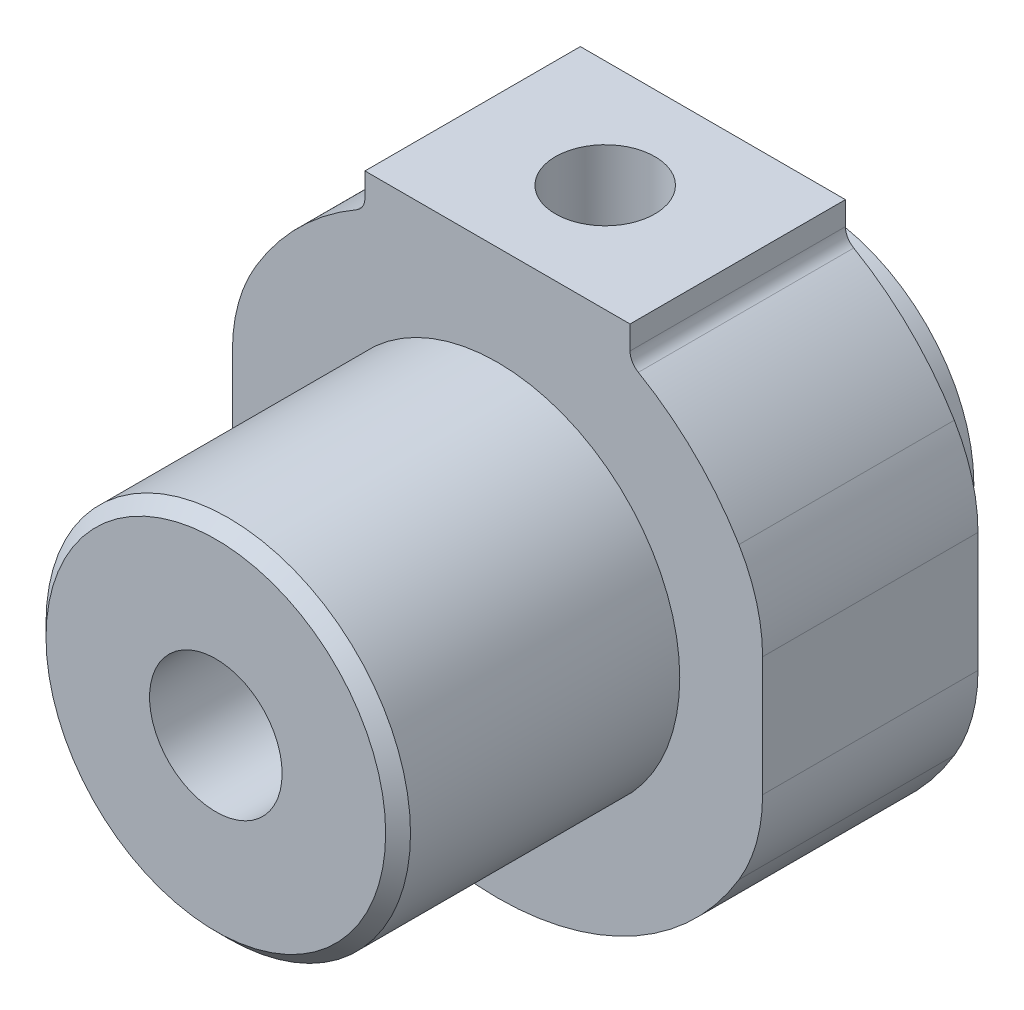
SolidWorks part; units mm, degrees
ref_plane "face" through (0, 0, 0) normal (0, 0, 1) x (1, 0, 0)
ref_plane "dessus" through (0, 0, 0) normal (0, 1, 0) x (1, 0, 0)
ref_plane "gauche" through (0, 0, 0) normal (1, 0, 0) x (0, 0, -1)
sketch "Esquisse1" plane through (0, 0, 0) normal (0, 0, 1) x (1, 0, 0)
  line L0 (0, 20) -> (0, -10) construction
  line L1 (-8, 17) -> (8, 17)
  line L2 (8, 17) -> (8, 15.5885)
  line L3 (0, 17) -> (0, -20) construction
  line L4 (-8, 17) -> (-8, 15.5885)
  arc A0 (-8.5, 14.7224) -> (8.5, 14.7224) centre (0, 0) ccw
  arc A1 (8.5, 14.7224) -> (8, 15.5885) centre (9, 15.5885) cw
  arc A2 (-8.5, 14.7224) -> (-8, 15.5885) centre (-9, 15.5885) ccw
  point P8 (0, 12.5)
  point P11 (8, 15)
  dimension "D1" = 34
  dimension "D4" = 1
  dimension "D2" = 17
  dimension "D3" = 8
extrude "Base-Extrusion" add sketch "Esquisse1" along normal blind 13
sketch "Esquisse2" plane through (0, 0, 13) normal (0, 0, 1) x (1, 0, 0)
  circle A0 centre (0, 0) radius 11
  dimension "D1" = 22
extrude "Boss.-Extru.1" add sketch "Esquisse2" along normal blind 17
chamfer "Chanfrein1" distance 0.75 angle 45
sketch "Esquisse3" plane through (0, 0, 0) normal (0, 0, -1) x (-1, 0, 0)
  circle A0 centre (0, 0) radius 9
  dimension "D1" = 18
extrude "Boss.-Extru.2" add sketch "Esquisse3" along normal blind 3
sketch "Esquisse4" plane through (0, 0, -3) normal (0, 0, -1) x (-1, 0, 0)
  circle A0 centre (0, 0) radius 9.75
  dimension "D1" = 19.5
extrude "Boss.-Extru.3" add sketch "Esquisse4" along normal blind 3
sketch "Esquisse5" plane through (0, 0, -6) normal (0, 0, -1) x (-1, 0, 0)
  circle A0 centre (0, 0) radius 5
  dimension "D1" = 10
extrude "Enlèv. mat.-Extru.1" cut sketch "Esquisse5" against normal blind 20
sketch "Esquisse6" plane through (0, 0, 30) normal (0, 0, 1) x (1, 0, 0)
  circle A0 centre (0, 0) radius 4
  dimension "D1" = 8
extrude "Enlèv. mat.-Extru.2" cut sketch "Esquisse6" against normal through all
sketch "Esquisse7" plane through (0, 17, 0) normal (0, 1, 0) x (-1, 0, 0)
  line L0 (8, 0) -> (-8, 0) construction
  circle A0 centre (0, 6.5) radius 3
  dimension "D1" = 6
  dimension "D2" = 6.5
extrude "Enlèv. mat.-Extru.4" cut sketch "Esquisse7" against normal up to next
sketch "Esquisse8" plane through (0, 0, 0) normal (0, 0, -1) x (-1, 0, 0)
  line L1 (-16, 20) -> (-26, 20)
  line L2 (-16, 20) -> (-16, -20)
  line L3 (-16, -20) -> (-26, -20)
  line L4 (-26, 20) -> (-26, -20)
  line L5 (16, 20) -> (36, 20)
  line L6 (16, 20) -> (16, -20)
  line L7 (16, -20) -> (36, -20)
  line L8 (36, 20) -> (36, -20)
  dimension "D1" = 32
  dimension "D2" = 16
extrude "Enlèv. mat.-Extru.5" cut sketch "Esquisse8" against normal through all
fillet "Congé1" radius 10
